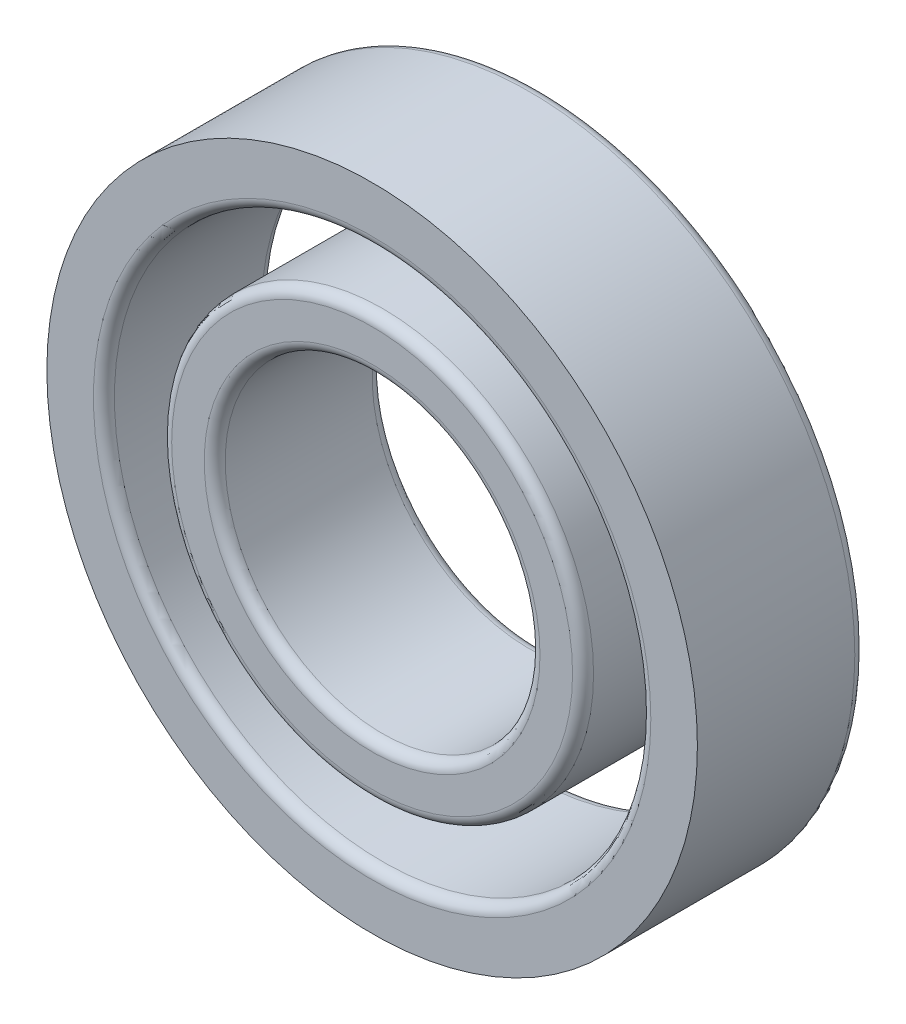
SolidWorks part; units mm, degrees
ref_plane "Plan de face" through (0, 0, 0) normal (0, 0, 1) x (1, 0, 0)
ref_plane "Plan de dessus" through (0, 0, 0) normal (0, 1, 0) x (1, 0, 0)
ref_plane "Plan de droite" through (0, 0, 0) normal (1, 0, 0) x (0, 0, -1)
sketch "Esquisse1" plane through (0, 0, 0) normal (0, 0, 1) x (1, 0, 0)
  circle A0 centre (0, 0) radius 31
  circle A1 centre (0, 0) radius 15
  circle A2 centre (0, 0) radius 20.1029
  circle A3 centre (0, 0) radius 25.5603
  dimension "D1" = 62
  dimension "D2" = 30
extrude "Boss.-Extru.1" add sketch "Esquisse1" along normal blind 16 contours A0 A3 | A2 A1
fillet "Congé1" radius 1 3 edges at (31, 0, 0) (25.5603, 0, 16) (25.5603, 0, 0)
fillet "Congé2" radius 1 4 edges at (15, 0, 16) (20.1029, 0, 16) (15, 0, 0) (20.1029, 0, 0)
